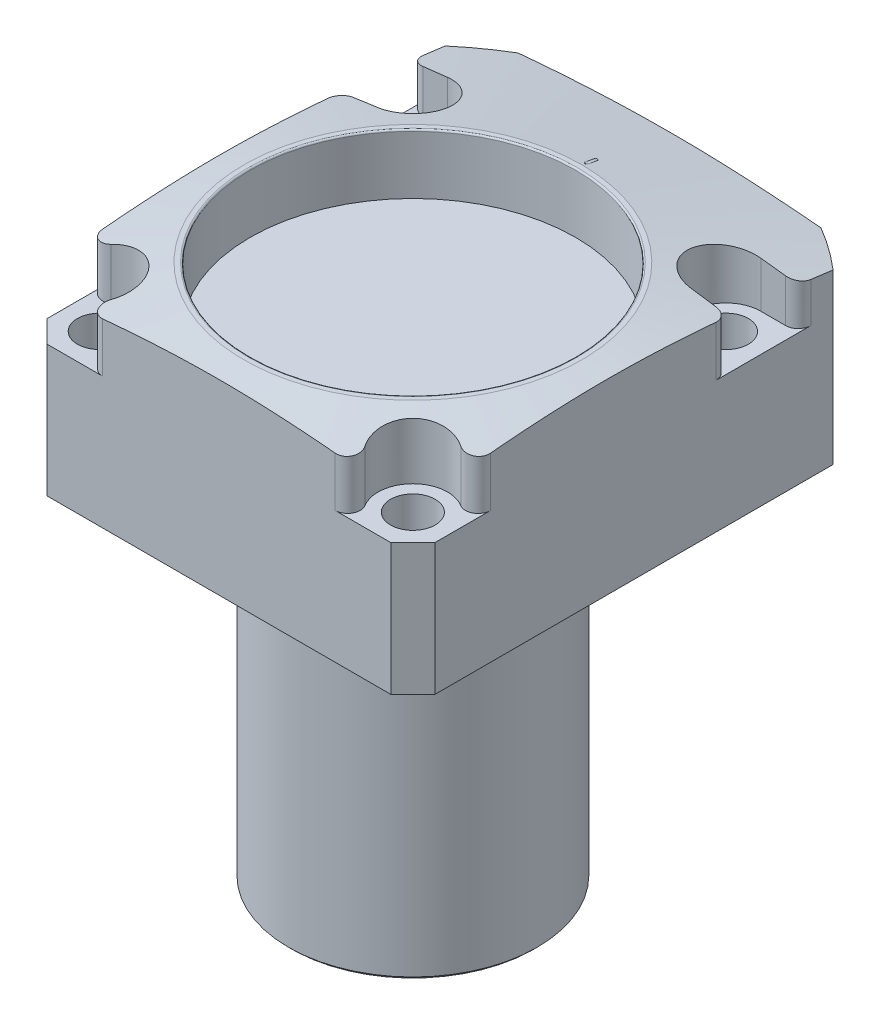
SolidWorks part; units mm, degrees
ref_plane "Front Plane" through (0, 0, 0) normal (0, 0, 1) x (1, 0, 0)
ref_plane "Top Plane" through (0, 0, 0) normal (0, 1, 0) x (1, 0, 0)
ref_plane "Right Plane" through (0, 0, 0) normal (1, 0, 0) x (0, 0, -1)
sketch "Sketch6" plane through (0, 0, 0) normal (0, 0, 1) x (1, 0, 0)
  line L0 (0, -8.9689) -> (0, 71.3762) construction
  line L1 (26.0096, 30.5562) -> (27, 30.5562)
  line L2 (27, 30.5562) -> (47.625, 26.9195)
  line L3 (47.625, 26.9195) -> (47.625, 0)
  line L4 (47.625, 0) -> (19.885, 0)
  line L5 (19.885, 0) -> (19.885, -54.7878)
  line L6 (19.885, -54.7878) -> (0, -54.7878)
  line L7 (0, -54.7878) -> (0, 21.0058)
  line L8 (26.0096, 30.5562) -> (26.0096, 21.0058)
  line L9 (26.0096, 21.0058) -> (0, 21.0058)
  dimension "D1" = 39.77
  dimension "D2" = 30.5562
  dimension "D3" = 54.7878
  dimension "D4" = 95.25
  dimension "D5" = 10
  dimension "D6" = 54
  dimension "D7" = 9.5504
  dimension "D8" = 52.0192
  dimension "D9" = 85.344
  dimension "D10" = 3.6367
revolve "Revolve3" add sketch "Sketch6" angle 360 about L0
fillet "Fillet7" radius 0.254 1 edges at (0, 30.5562, -26.0096)
sketch "Sketch7" plane through (0, 0, 0) normal (0, -1, 0) x (1, 0, 0)
  line L0 (0, 0) -> (0, -52.3237) construction
  line L1 (-30.9944, 30.9944) -> (30.9943, 30.9944)
  line L2 (-30.9944, 30.9944) -> (-30.9944, -41.0146)
  line L3 (-30.9944, -41.0146) -> (30.9944, -41.0146)
  line L4 (30.9943, 30.9944) -> (30.9944, -41.0146)
  dimension "D1" = 61.9887
  dimension "D2" = 72.009
  dimension "D3" = 30.9944
  dimension "D4" = 30.9944
  dimension "D5" = 41.0146
extrude "Cut-Extrude5" cut sketch "Sketch7" against normal through all flip side to cut
sketch "Sketch8" plane through (0, 0, 0) normal (0, -1, 0) x (1, 0, 0)
  circle A0 centre (-25.019, 25.019) radius 3.5687
  dimension "D1" = 7.1374
  dimension "D2" = 25.019
  dimension "D3" = 25.019
extrude "Cut-Extrude6" cut sketch "Sketch8" against normal through all
pattern_circular "CirPattern2" count 4 over 360 about axis through (0, 0, 0) along (0, 1, 0) of "Cut-Extrude6"
chamfer "Chamfer1" distance 3.5052 angle 45 2 edges at (-30.9944, 13.7941, 30.9944) (30.9943, 13.7941, 30.9944)
sketch "Sketch9" plane through (0, 30.5562, 0) normal (0, 1, 0) x (1, 0, 0)
  line L0 (-30.9944, -27.4891) -> (-27.4892, -30.9944) construction
  line L1 (-27.4892, -30.9944) -> (27.4891, -30.9944) construction
  line L2 (30.9944, 30.5816) -> (30.9944, 19.4564)
  line L3 (-30.9944, -27.4891) -> (-27.4892, -30.9944)
  line L4 (30.9944, 19.4564) -> (25.019, 19.4564)
  line L5 (25.019, 30.5816) -> (30.9944, 30.5816)
  line L6 (-25.019, 30.5816) -> (-30.9944, 30.5816)
  line L7 (-30.9944, 36.1592) -> (-30.9944, -27.4891) construction
  line L8 (-30.9944, 19.4564) -> (-25.019, 19.4564)
  line L9 (-30.9944, 30.5816) -> (-30.9944, 19.4564)
  line L10 (-27.4892, -30.9944) -> (-23.1276, -30.9944)
  line L11 (0, 0) -> (0, 26.6366) construction
  line L13 (-30.9944, -23.1276) -> (-28.9524, -21.0856)
  line L14 (-21.0856, -28.9524) -> (-23.1276, -30.9944)
  line L15 (-30.9944, -23.1276) -> (-30.9944, -27.4891)
  line L16 (30.9944, -23.1276) -> (30.9944, -27.4891)
  line L17 (21.0856, -28.9524) -> (23.1276, -30.9944)
  line L18 (30.9944, -23.1276) -> (28.9524, -21.0856)
  line L19 (27.4891, -30.9944) -> (23.1276, -30.9944)
  line L20 (30.9944, -27.4891) -> (27.4891, -30.9944)
  arc A0 (-21.0856, -28.9524) -> (-28.9524, -21.0856) centre (-25.019, -25.019) ccw
  arc A1 (-25.019, 19.4564) -> (-25.019, 30.5816) centre (-25.019, 25.019) ccw
  arc A2 (21.0856, -28.9524) -> (28.9524, -21.0856) centre (25.019, -25.019) cw
  arc A3 (25.019, 19.4564) -> (25.019, 30.5816) centre (25.019, 25.019) cw
  dimension "D1" = 11.1252
extrude "Cut-Extrude7" cut sketch "Sketch9" against normal offset from surface (9.5504 mm away) 21.0058
fillet "Fillet4" radius 2.0066 8 edges at (-30.9944, 24.9351, -19.4564) (30.9944, 24.3226, -30.5816) (30.9944, 24.9351, -19.4564) (30.9944, 24.7519, 23.1276) (23.1276, 24.7519, 30.9944) (-23.1276, 24.7519, 30.9944) (-30.9944, 24.7519, 23.1276) (-30.9944, 24.3226, -30.5816)
fillet "Fillet5" radius 0.4013 1 edges at (0, 0, -19.885)
chamfer "Chamfer2" distance 0.5004 angle 45 1 edges at (0, -54.7878, -19.885)
ref_plane "Plane1" through (0, 17.018, 0) normal (0, -1, 0) x (1, 0, 0)
sketch "Sketch11" plane through (0, 17.018, 0) normal (0, -1, 0) x (1, 0, 0)
  line L0 (-14, -4.7006) -> (-14, -58.3255) construction
  line L1 (-24.2062, -41.0146) -> (24.2062, -41.0146) construction
  line L2 (-20.1849, -40.7646) -> (-19.6396, -38.1992)
  line L3 (-19.6396, -38.1992) -> (-18.9784, -37.538)
  line L10 (-14, -41.0146) -> (-24.4775, -41.0146)
  line L11 (-14, -26.0326) -> (-14, -41.0146)
  line L12 (-18.9784, -26.0326) -> (-14, -26.0326)
  line L13 (-18.9784, -37.538) -> (-18.9784, -26.0326)
  line L15 (-24.4775, -40.7646) -> (-20.1849, -40.7646)
  line L16 (-24.4775, -41.0146) -> (-24.4775, -40.7646)
  dimension "D1" = 14
  dimension "D2" = 0.25
  dimension "D3" = 14.732
  dimension "D4" = 9.9568
  dimension "D5" = 20.955
  dimension "D6" = 12
  dimension "D7" = 45
  dimension "D8" = 2.5654
  dimension "D9" = 12.3698
revolve "Cut-Revolve5" cut sketch "Sketch11" angle 360 about L0
ref_plane "Plane2" through (0, 0, -32.7406) normal (0, 0, 1) x (1, 0, 0)
sketch "Sketch13" plane through (0, 0, -32.7406) normal (0, 0, 1) x (1, 0, 0)
  line L0 (-17.4544, 17.7546) -> (-17.4544, 5.5009)
  line L1 (-18.572, 2.7432) -> (-18.1293, 4.826)
  line L2 (-18.572, 2.7432) -> (-19.4991, 2.7432)
  line L3 (-19.4991, 2.7432) -> (-19.4991, 0)
  line L4 (-20.2863, 0) -> (20.2863, 0) construction
  line L5 (-19.4991, 0) -> (-14, 0)
  line L6 (-14, 0) -> (-14, 17.7546)
  line L7 (-14, 17.7546) -> (-17.4544, 17.7546)
  line L8 (-14, 15.2099) -> (-14, -4.3918) construction
  line L9 (-18.1293, 4.826) -> (-17.4544, 5.5009)
  line L10 (-18.572, 2.7432) -> (-14, 2.7432) construction
  dimension "D1" = 14
  dimension "D2" = 6.9088
  dimension "D3" = 15.0114
  dimension "D4" = 2.7432
  dimension "D5" = 10.9982
  dimension "D6" = 2.0828
  dimension "D7" = 12
  dimension "D8" = 45
  dimension "D9" = 9.144
revolve "Cut-Revolve6" cut sketch "Sketch13" angle 360 about L8
sketch "Sketch1" plane through (-3.5242, 5.6324, -32.7406) normal (0, 0, 1) x (1, 0, 0)
  line L0 (-10.4758, 0) -> (-10.4758, 50000) construction
  line L1 (-8.8883, 2.521) -> (-6.6023, 2.521)
  line L2 (-6.6023, 2.521) -> (-6.6023, -0.3754)
  line L3 (-6.5642, -2.8892) -> (50000, -2.8892) construction
  line L4 (-7.4786, -1.289) -> (-7.4786, -1.9748)
  line L5 (-6.5642, -2.8892) -> (-5.0148, -2.8892)
  line L6 (-5.0148, -2.8892) -> (-5.0148, -4.3116)
  line L7 (-5.0148, -4.3116) -> (-5.6928, -4.3116)
  line L8 (-7.8088, -4.3116) -> (-7.8088, -5.4292)
  line L9 (-7.8088, -5.4292) -> (-8.8883, -5.4292)
  line L10 (-8.8883, -5.4292) -> (-8.8883, 2.521)
  line L11 (-1000, -2.8892) -> (-8.8883, -2.8892) construction
  line L12 (-6.1147, -4.3116) -> (-7.8088, -4.3116)
  arc A0 (-6.6023, -0.3754) -> (-7.4786, -1.289) centre (-6.5642, -1.289) ccw
  arc A1 (-7.4786, -1.9748) -> (-6.5642, -2.8892) centre (-6.5642, -1.9748) ccw
  arc A2 (-6.1147, -4.3116) -> (-5.6928, -4.3116) centre (-5.9038, -5.1752) ccw
  dimension "D8" = 1.6002
  dimension "D9" = 0.9144
  dimension "D10" = 7.9502
  dimension "D11" = 1.778
  dimension "D1" = 7.747
  dimension "D2" = 5.9944
  dimension "D3" = 10.922
  dimension "D4" = 5.334
  dimension "D5" = 3.175
  dimension "D6" = 1.4224
  dimension "D7" = 2.54
  dimension "D12" = 0.8636
revolve "Revolve1" add sketch "Sketch1" angle 360 about L0
sketch "Sketch2" plane through (-14, 0.2032, -32.7406) normal (0, -1, 0) x (0, 0, 1)
  line L0 (0, 0) -> (0, 50000) construction
  line L1 (0, 1.8331) -> (1.5875, 0.9165)
  line L2 (1.5875, 0.9165) -> (1.5875, -0.9165)
  line L3 (1.5875, -0.9165) -> (0, -1.8331)
  line L4 (0, -1.8331) -> (-1.5875, -0.9165)
  line L5 (-1.5875, -0.9165) -> (-1.5875, 0.9165)
  line L6 (-1.5875, 0.9165) -> (0, 1.8331)
  circle A0 centre (0, 0) radius 1.5875 construction
  dimension "D1" = 3.175
extrude "Cut-Extrude1" cut sketch "Sketch2" against normal up to surface (7.9502 mm away)
other "PORT_ADTAPTER<1>"
sketch "Sketch17" plane through (0, 0, 0) normal (1, 0, 0) x (0, 0, -1)
  line L0 (26.7557, 31.371) -> (29.9871, 30.8012) construction
  line L1 (41.0146, 28.085) -> (27, 30.5562) construction
  line L2 (27.5003, 30.468) -> (29.4764, 30.1195) construction
  line L3 (27.8786, 31.173) -> (29.3621, 30.9114) construction
  line L5 (27.7396, 30.3851) -> (29.2231, 30.1235)
  line L6 (27.0906, 31.3119) -> (30.15, 30.7725)
  arc A0 (27.0906, 31.3119) -> (27.7396, 30.3851) centre (27.8786, 31.173) ccw
  arc A1 (29.2231, 30.1235) -> (30.15, 30.7725) centre (29.3621, 30.9114) ccw
  dimension "D2" = 1.6002
  dimension "D1" = 0.76
  dimension "D3" = 2.0066
  dimension "D4" = 0.508
revolve "Cut-Revolve7" cut sketch "Sketch17" angle 360 about L0
equation "\"D3@Sketch8\"=\"D2@Sketch8\""
equation "\"D3@Sketch7\"=\"D4@Sketch7\""
